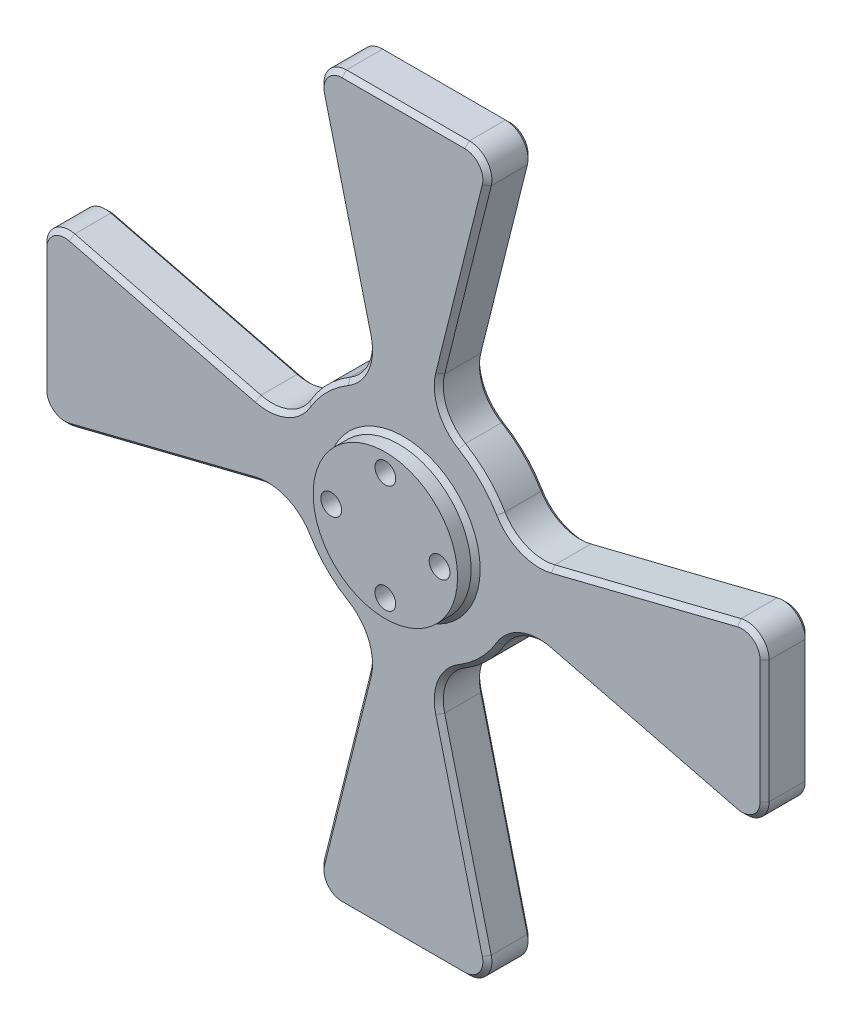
SolidWorks part; units mm, degrees
ref_plane "Ebene vorne" through (0, 0, 0) normal (0, 0, 1) x (1, 0, 0)
ref_plane "Ebene oben" through (0, 0, 0) normal (0, 1, 0) x (1, 0, 0)
ref_plane "Ebene rechts" through (0, 0, 0) normal (1, 0, 0) x (0, 0, -1)
sketch "Skizze1" plane through (0, 0, 0) normal (0, 0, 1) x (1, 0, 0)
  circle A0 centre (0, 0) radius 12.5
  dimension "D1" = 25
extrude "Aufsatz-Linear austragen1" add sketch "Skizze1" along normal blind 5
sketch "Skizze2" plane through (0, 0, 5) normal (0, 0, 1) x (1, 0, 0)
  circle A0 centre (0, 0) radius 8
  dimension "D1" = 16
extrude "Aufsatz-Linear austragen2" add sketch "Skizze2" along normal blind 2
sketch "Skizze6" plane through (0, 0, 0) normal (0, 0, -1) x (-1, 0, 0)
  line L0 (0, 0) -> (0, 40) construction
  line L1 (0, 0) -> (9.2234, 36.8937)
  line L2 (6.7981, 40) -> (-6.7981, 40)
  line L3 (0, 0) -> (-9.2234, 36.8937)
  arc A0 (9.2234, 36.8937) -> (6.7981, 40) centre (6.7981, 37.5) ccw
  arc A1 (-9.2234, 36.8937) -> (-6.7981, 40) centre (-6.7981, 37.5) cw
  point P6 (10, 40)
  dimension "D3" = 2.5
  dimension "D1" = 10
  dimension "D2" = 40
extrude "Aufsatz-Linear austragen3" add sketch "Skizze6" against normal up to surface (5 mm away)
pattern_circular "Kreismuster1" count 4 over 360 about axis through (0, 0, 0) along (0, 0, 1) of "Aufsatz-Linear austragen3"
sketch "Skizze3" plane through (0, 0, 7) normal (0, 0, 1) x (1, 0, 0)
  circle A0 centre (0, 6) radius 1.15
  circle A4 centre (6, 0) radius 1.15
  circle A5 centre (0, -6) radius 1.15
  circle A6 centre (-6, 0) radius 1.15
  circle A7 centre (0, 0) radius 6 construction
  point P12 (0, 0)
  dimension "D1" = 2.3
  dimension "D2" = 6
  dimension "D3" = 4
extrude "Schnitt-Linear austragen1" cut sketch "Skizze3" against normal blind 12
fillet "Verrundung1" radius 5 8 edges at (-12.1268, -3.0317, 2.5) (-12.1268, 3.0317, 2.5) (-3.0317, 12.1268, 2.5) (3.0317, 12.1268, 2.5) (12.1268, 3.0317, 2.5) (12.1268, -3.0317, 2.5) (3.0317, -12.1268, 2.5) (-3.0317, -12.1268, 2.5)
chamfer "Fase1" distance 0.5 angle 45 65 edges at (-8.8388, 8.8388, 0) (-8.8388, 8.8388, 5) (-6.6454, 26.5817, 5) (-6.6454, 26.5817, 0) (8.8388, 8.8388, 5) (8.8388, 8.8388, 0) (26.5817, 6.6454, 5) (26.5817, 6.6454, 0) (8.8388, -8.8388, 0) (8.8388, -8.8388, 5) (6.6454, -26.5817, 5) (6.6454, -26.5817, 0) (-8.8388, -8.8388, 0) (-8.8388, -8.8388, 5) (6.6454, 26.5817, 5) (-26.5817, -6.6454, 5) (-26.5817, -6.6454, 0) (-13.1306, 4.3042, 5) (-13.1306, 4.3042, 0) (6.6454, 26.5817, 0) (-4.3042, 13.1306, 0) (-4.3042, 13.1306, 5) (4.3042, 13.1306, 5) (4.3042, 13.1306, 0) (13.1306, 4.3042, 0) (13.1306, 4.3042, 5) (13.1306, -4.3042, 5) (13.1306, -4.3042, 0) (-8.7686, 39.0385, 0) (4.3042, -13.1306, 0) (4.3042, -13.1306, 5) (-4.3042, -13.1306, 5) (0, 40, 0) (-4.3042, -13.1306, 0) (-13.1306, -4.3042, 0) (-13.1306, -4.3042, 5) (8.7686, 39.0385, 0) (-8.7686, 39.0385, 5) (0, 40, 5) (8.7686, 39.0385, 5) (-26.5817, 6.6454, 5) (-26.5817, 6.6454, 0) (-39.0385, -8.7686, 0) (-40, 0, 0) (-39.0385, 8.7686, 0) (-39.0385, -8.7686, 5) (-40, 0, 5) (-39.0385, 8.7686, 5) (8, 0, 5) (-6.6454, -26.5817, 5) (-6.6454, -26.5817, 0) (8.7686, -39.0385, 0) (0, -40, 0) (-8.7686, -39.0385, 0) (8.7686, -39.0385, 5) (0, -40, 5) (-8.7686, -39.0385, 5) (26.5817, -6.6454, 5) (26.5817, -6.6454, 0) (39.0385, 8.7686, 0) (40, 0, 0) (39.0385, -8.7686, 0) (39.0385, 8.7686, 5) (40, 0, 5) (39.0385, -8.7686, 5)
